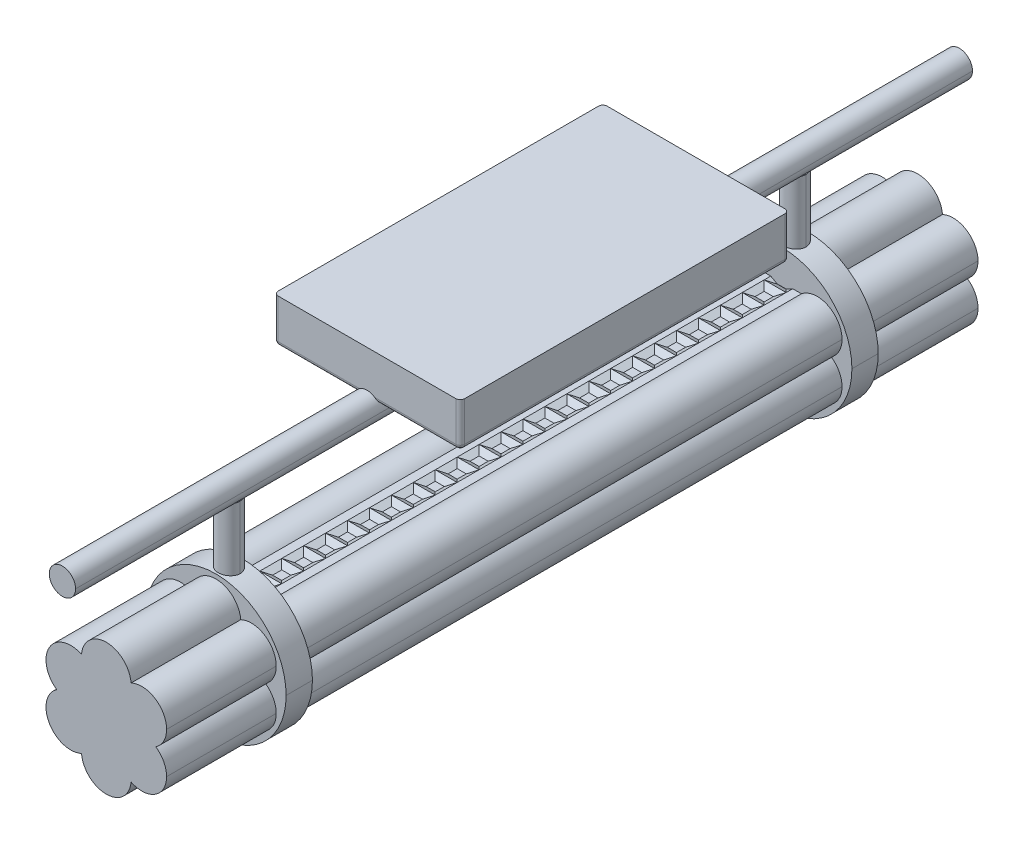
SolidWorks part; units mm, degrees
ref_plane "Alzado" through (0, 0, 0) normal (0, 0, 1) x (1, 0, 0)
ref_plane "Planta" through (0, 0, 0) normal (0, 1, 0) x (1, 0, 0)
ref_plane "Vista lateral" through (0, 0, 0) normal (1, 0, 0) x (0, 0, -1)
imported_body "A1355.STEP<1>"
sketch "Croquis4" plane through (0, -28, 0) normal (0, 1, 0) x (1, 0, 0)
  line L1 (63513.5893, -664.566) -> (63598.5893, -664.566)
  line L2 (63513.5893, -664.566) -> (63513.5893, -814.566)
  line L3 (63513.5893, -814.566) -> (63598.5893, -814.566)
  line L4 (63598.5893, -664.566) -> (63598.5893, -814.566)
  line L5 (63513.5893, -664.566) -> (63598.5893, -814.566) construction
  line L6 (63513.5893, -814.566) -> (63598.5893, -664.566) construction
  point P0 (63556.0778, -738.973)
  dimension "D2" = 150
  dimension "D1" = 85
extrude "Saliente-Extruir2" add sketch "Croquis4" against normal up to surface (20 mm away) contours L2 L1 L4 L3
fillet "Redondeo1" radius 2 10 edges at (63513.5893, -38, 664.566) (63532.2131, -48, 664.566) (63513.5893, -38, 814.566) (63513.5893, -48, 739.566) (63532.2131, -48, 814.566) (63598.5893, -38, 814.566) (63598.5893, -38, 664.566) (63579.9539, -48, 664.566) (63579.9539, -48, 814.566) (63598.5893, -48, 739.566)
sketch "Croquis2" plane through (0, -28, 0) normal (0, 1, 0) x (1, 0, 0)
  circle A0 centre (63556.0778, -738.973) radius 42
extrude "Cortar-Extruir1" cut sketch "Croquis2" against normal blind 21
sketch "Croquis3" plane through (0, 0, 953.473) normal (0, 0, 1) x (1, 0, 0)
  circle A0 centre (63556.0778, -50.9213) radius 6.6814
extrude "Saliente-Extruir1" add sketch "Croquis3" against normal up to surface (409 mm away)
